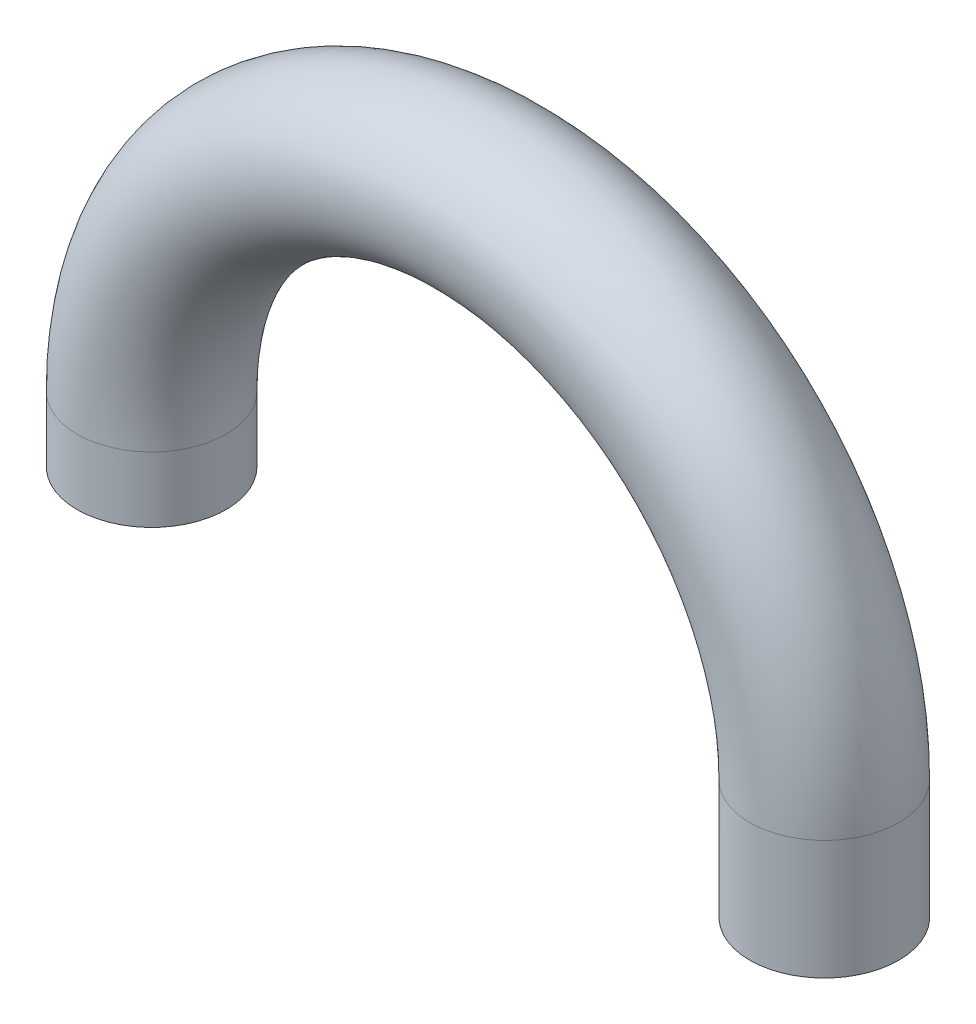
SolidWorks part; units mm, degrees
ref_plane "Front Plane" through (0, 0, 0) normal (0, 0, 1) x (1, 0, 0)
ref_plane "Top Plane" through (0, 0, 0) normal (0, 1, 0) x (1, 0, 0)
ref_plane "Right Plane" through (0, 0, 0) normal (1, 0, 0) x (0, 0, -1)
sketch "Sketch1" plane through (0, 0, 0) normal (0, 0, 1) x (1, 0, 0)
  line L0 (0, 0) -> (0, 3.4798)
  line L1 (35.8308, 3.4798) -> (35.8308, -2.8702)
  arc A0 (0, 3.4798) -> (35.8308, 3.4798) centre (17.9154, 3.4798) cw
  point P0 (0, 0)
  point P1 (35.8308, 3.4798)
  dimension "D1" = 35.9994
  dimension "D2" = 3.4798
  dimension "D3" = 6.35
sketch "Sketch2" plane through (0, 0, 0) normal (0, 1, 0) x (1, 0, 0)
  circle A0 centre (0, 0) radius 3.9688
  dimension "D1" = 7.9375
sweep "Sweep1" add profiles "Sketch2" path "Sketch1"
